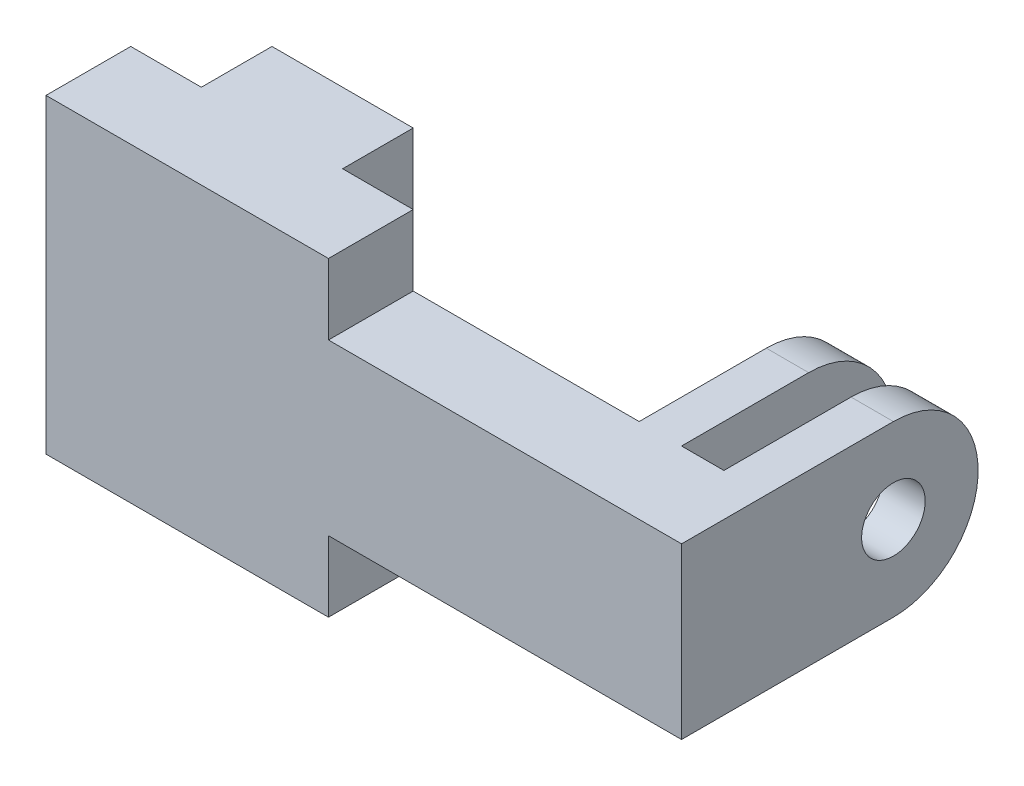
SolidWorks part; units mm, degrees
ref_plane "Front Plane" through (0, 0, 0) normal (0, 0, 1) x (1, 0, 0)
ref_plane "Top Plane" through (0, 0, 0) normal (0, 1, 0) x (1, 0, 0)
ref_plane "Right Plane" through (0, 0, 0) normal (1, 0, 0) x (0, 0, -1)
sketch "Sketch1" plane through (0, 0, 0) normal (0, 0, 1) x (1, 0, 0)
  line L1 (-2.5, 6) -> (22.5, 6)
  line L2 (-22.5, 6) -> (-22.5, -6)
  line L3 (-2.5, -6) -> (22.5, -6)
  line L4 (22.5, 6) -> (22.5, -6)
  line L5 (-22.5, 6) -> (22.5, -6) construction
  line L6 (-22.5, -6) -> (22.5, 6) construction
  line L8 (-22.5, 6) -> (-22.5, 11)
  line L9 (-22.5, 11) -> (-2.5, 11)
  line L10 (-2.5, 6) -> (-2.5, 11)
  line L12 (-22.5, -6) -> (-22.5, -11)
  line L13 (-22.5, -11) -> (-2.5, -11)
  line L14 (-2.5, -6) -> (-2.5, -11)
  point P0 (0, 0)
  dimension "D1" = 45
  dimension "D2" = 12
  dimension "D3" = 5
  dimension "D4" = 5
  dimension "D5" = 20
  dimension "D6" = 20
  dimension "D7" = 12
  dimension "D8" = 6
extrude "Boss-Extrude1" add sketch "Sketch1" along normal blind 6
sketch "Sketch2" plane through (0, 0, 0) normal (0, 0, -1) x (-1, 0, 0)
  line L0 (2.5, -6) -> (-22.5, -6) construction
  line L1 (-22.5, 6) -> (-19.5, 6)
  line L2 (-22.5, 6) -> (-22.5, -6)
  line L3 (-22.5, -6) -> (-19.5, -6)
  line L4 (-19.5, 6) -> (-19.5, -6)
  line L5 (-22.5, 6) -> (2.5, 6) construction
  line L6 (-16.5, 6) -> (-13.5, 6)
  line L7 (-16.5, 6) -> (-16.5, -6)
  line L8 (-16.5, -6) -> (-13.5, -6)
  line L9 (-13.5, 6) -> (-13.5, -6)
  dimension "D1" = 3
  dimension "D2" = 3
  dimension "D3" = 3
extrude "Boss-Extrude2" add sketch "Sketch2" along normal blind 15
sketch "Sketch3" plane through (22.5, 0, 0) normal (1, 0, 0) x (0, 0, -1)
  line L0 (-6, 0) -> (15, 0) construction
  line L1 (-6, -6) -> (-6, 6) construction
  line L2 (15, 6) -> (15, -6) construction
  line L3 (9, 6) -> (9, -6) construction
  line L4 (-6, 6) -> (15, 6) construction
  line L5 (-6, -6) -> (15, -6) construction
  line L6 (9, 6) -> (9, 7)
  line L7 (9, 7) -> (18, 7)
  line L8 (18, 7) -> (18, -8)
  line L9 (18, -8) -> (9, -8)
  line L10 (9, -8) -> (9, -6)
  circle A0 centre (9, 0) radius 2.25
  arc A1 (9, 6) -> (9, -6) centre (9, 0) cw
  point P12 (9, 0)
  dimension "D2" = 4.5
  dimension "D1" = 6
  dimension "D3" = 1
  dimension "D4" = 9
  dimension "D5" = 15
extrude "Cut-Extrude1" cut sketch "Sketch3" against normal through all contours A0 | A1 M7 M6 | A1 M6 M5
sketch "Sketch4" plane through (0, 0, 0) normal (0, 0, -1) x (-1, 0, 0)
  line L0 (2.5, 11) -> (22.5, 11) construction
  line L1 (7.5, 11) -> (17.5, 11)
  line L2 (7.5, 11) -> (7.5, -11)
  line L3 (7.5, -11) -> (17.5, -11)
  line L4 (17.5, 11) -> (17.5, -11)
  line L5 (22.5, -11) -> (2.5, -11) construction
  line L6 (22.5, 11) -> (22.5, -11) construction
  dimension "D1" = 5
  dimension "D2" = 10
extrude "Boss-Extrude3" add sketch "Sketch4" along normal blind 5
sketch "Sketch5" plane through (-17.5, 0, 0) normal (-1, 0, 0) x (0, 0, 1)
  line L0 (0, -11) -> (0, 11) construction
  line L1 (0, 7.5) -> (-2, 7.5)
  line L2 (0, 7.5) -> (0, -7.5)
  line L3 (0, -7.5) -> (-2, -7.5)
  line L4 (-2, 7.5) -> (-2, -7.5)
  line L5 (-5, -11) -> (0, -11) construction
  dimension "D1" = 15
  dimension "D2" = 2
  dimension "D3" = 3.5
extrude "Cut-Extrude2" cut sketch "Sketch5" against normal up to next contours L4 L3 L2 L1
